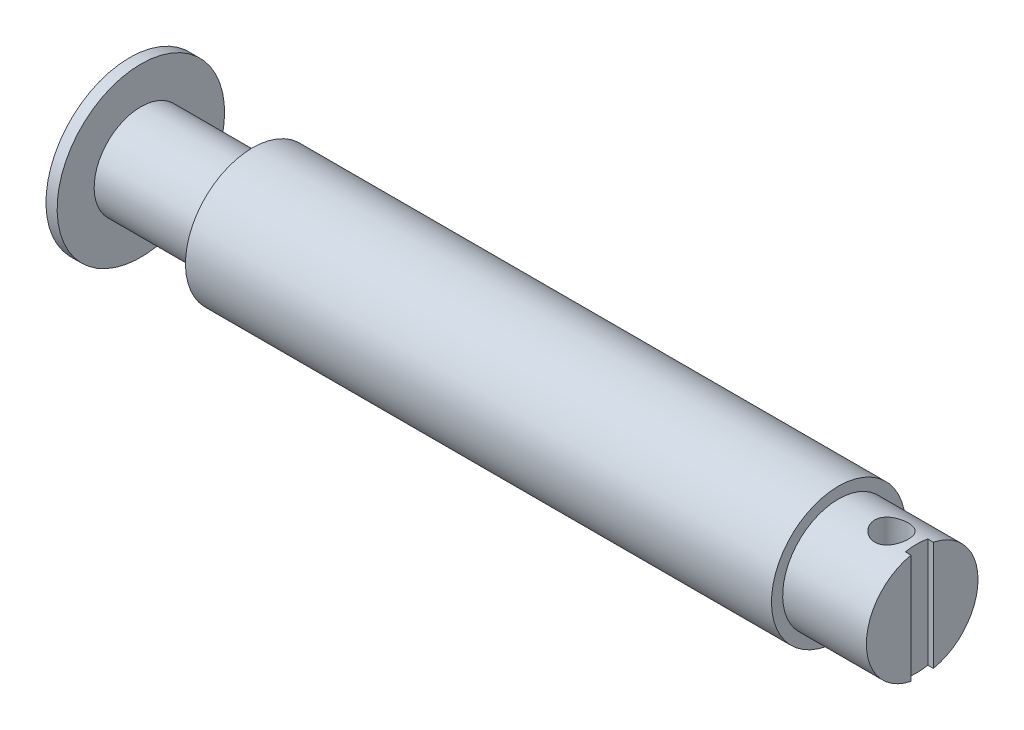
SolidWorks part; units mm, degrees
ref_plane "Plan de face" through (0, 0, 0) normal (0, 0, 1) x (1, 0, 0)
ref_plane "Plan de dessus" through (0, 0, 0) normal (0, 1, 0) x (1, 0, 0)
ref_plane "Plan de droite" through (0, 0, 0) normal (1, 0, 0) x (0, 0, -1)
sketch "Esquisse1" plane through (0, 0, 0) normal (0, 0, 1) x (1, 0, 0)
  line L0 (-54, 15) -> (-54, 0)
  line L1 (-54, 0) -> (73, 0)
  line L2 (73, 0) -> (73, 12)
  line L3 (73, 12) -> (-32, 12)
  line L4 (-32, 12) -> (-32, 8.3646)
  line L5 (-32, 8.3646) -> (-52, 8.3646)
  line L6 (-52, 8.3646) -> (-52, 15)
  line L7 (-52, 15) -> (-54, 15)
  line L8 (-54, 0) -> (73, 0) construction
revolve "Révolution1" add sketch "Esquisse1" angle 360 about L8
sketch "Esquisse2" plane through (73, 0, 0) normal (1, 0, 0) x (0, 0, -1)
  circle A0 centre (0, 0) radius 10
extrude "Extrusion1" add sketch "Esquisse2" along normal blind 15
sketch "Esquisse3" plane through (88, 0, 0) normal (1, 0, 0) x (0, 0, -1)
  line L0 (2, -9.798) -> (2, 9.798)
  arc A0 (2, 9.798) -> (2, -9.798) centre (0, 0) ccw
extrude "Enlèv. mat.-Extru.1" cut sketch "Esquisse3" against normal blind 1
sketch "Esquisse4" plane through (87, 0, 0) normal (1, 0, 0) x (0, 0, -1)
  line L0 (-2, 9.798) -> (-2, -9.798)
  arc A0 (-2, -9.798) -> (-2, 9.798) centre (0, 0) cw
extrude "Extrusion2" add sketch "Esquisse4" along normal blind 1
sketch "Esquisse5" plane through (0, 0, 0) normal (0, 0, 1) x (1, 0, 0)
  line L0 (79.5, -10) -> (82.5, -10)
  line L1 (82.5, -10) -> (82.5, 10)
  line L2 (82.5, 10) -> (79.5, 10)
  line L3 (79.5, 10) -> (79.5, -10)
  line L4 (82.5, -10) -> (82.5, 10) construction
revolve "Enlèvement de matière-Révolution1" cut sketch "Esquisse5" angle 360 about L4
